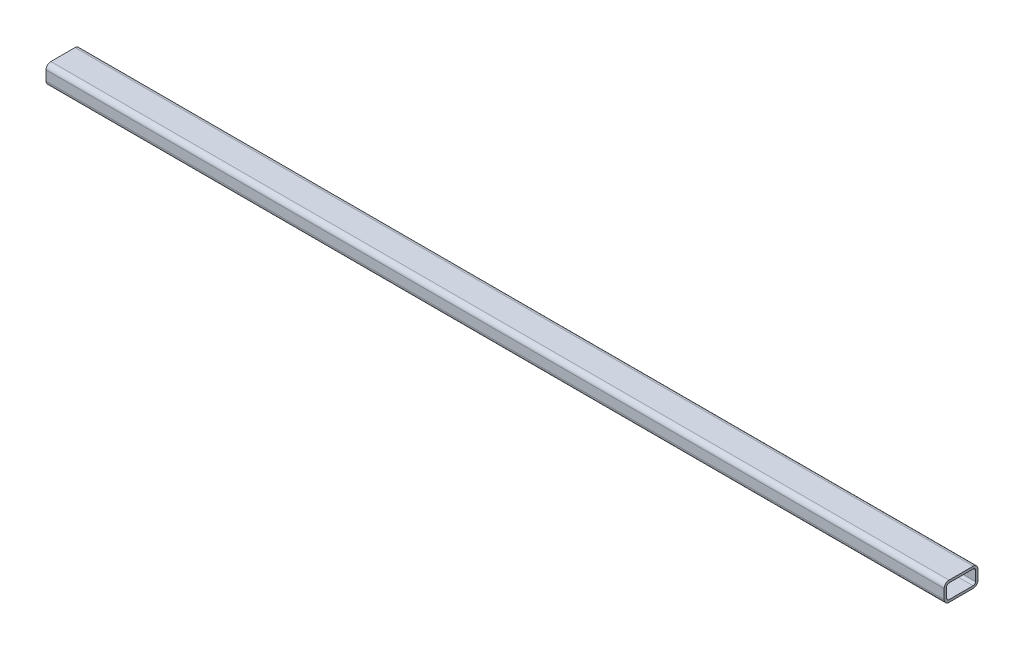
SolidWorks part; units mm, degrees
ref_plane "Plan1" through (0, 0, 0) normal (0, 0, 1) x (1, 0, 0)
ref_plane "Plan2" through (0, 0, 0) normal (0, 1, 0) x (1, 0, 0)
ref_plane "Plan3" through (0, 0, 0) normal (1, 0, 0) x (0, 0, -1)
sketch "Esquisse1" plane through (0, 0, 0) normal (1, 0, 0) x (0, 0, -1)
  line L0 (-17.5, 0) -> (17.5, 0) construction
  line L1 (-12.5, 10) -> (12.5, 10)
  line L2 (-17.5, 5) -> (-17.5, -5)
  line L3 (-12.5, -10) -> (12.5, -10)
  line L4 (17.5, 5) -> (17.5, -5)
  line L5 (0, -10) -> (0, 10) construction
  line L6 (-12.5, 7.5) -> (12.5, 7.5)
  line L7 (15, 5) -> (15, -5)
  line L8 (-12.5, -7.5) -> (12.5, -7.5)
  line L9 (-15, 5) -> (-15, -5)
  arc A0 (17.5, 5) -> (12.5, 10) centre (12.5, 5) ccw
  arc A1 (-17.5, 5) -> (-12.5, 10) centre (-12.5, 5) cw
  arc A2 (-12.5, -10) -> (-17.5, -5) centre (-12.5, -5) cw
  arc A3 (17.5, -5) -> (12.5, -10) centre (12.5, -5) cw
  arc A4 (-15, 5) -> (-12.5, 7.5) centre (-12.5, 5) cw
  arc A5 (15, 5) -> (12.5, 7.5) centre (12.5, 5) ccw
  arc A6 (15, -5) -> (12.5, -7.5) centre (12.5, -5) cw
  arc A7 (-12.5, -7.5) -> (-15, -5) centre (-12.5, -5) cw
  dimension "e" = 2.5
  dimension "C" = 20
  dimension "B" = 35
extrude "Base-Extrusion" add sketch "Esquisse1" along normal blind 930
